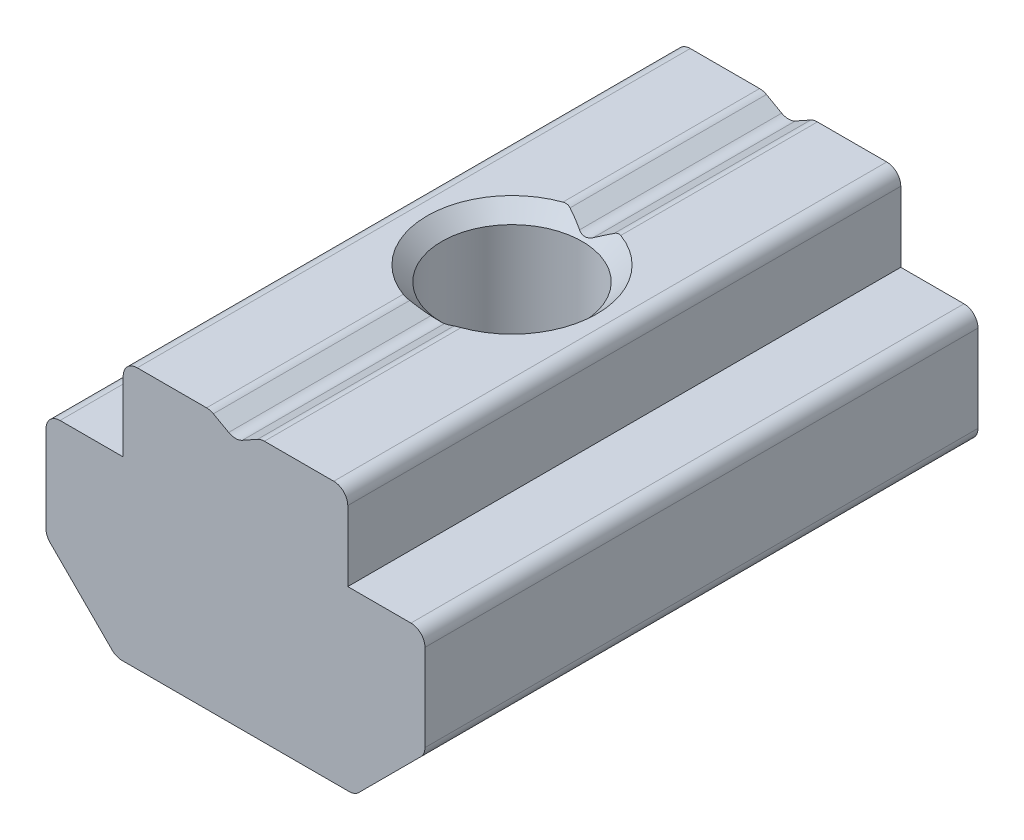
SolidWorks part; units mm, degrees
ref_plane "Front Plane" through (0, 0, 0) normal (0, 0, 1) x (1, 0, 0)
ref_plane "Top Plane" through (0, 0, 0) normal (0, 1, 0) x (1, 0, 0)
ref_plane "Right Plane" through (0, 0, 0) normal (1, 0, 0) x (0, 0, -1)
sketch "Sketch1" plane through (0, 0, 0) normal (0, 1, 0) x (1, 0, 0)
  line L1 (0, 0) -> (13.5, 0)
  line L2 (0, 0) -> (0, 19.7)
  line L3 (0, 19.7) -> (13.5, 19.7)
  line L4 (13.5, 0) -> (13.5, 19.7)
  dimension "D1" = 13.5
  dimension "D2" = 19.7
extrude "Boss-Extrude1" add sketch "Sketch1" along normal blind 9.3
sketch "Sketch2" plane through (0, 9.3, 0) normal (0, 1, 0) x (1, 0, 0)
  line L6 (13.5, 19.7) -> (0, 19.7) construction
  line L7 (2.75, 19.7) -> (10.75, 19.7)
  line L8 (2.75, 19.7) -> (2.75, 0)
  line L9 (2.75, 0) -> (10.75, 0)
  line L10 (10.75, 19.7) -> (10.75, 0)
  line L11 (0, 0) -> (13.5, 0) construction
  line L13 (2.75, 19.7) -> (0, 19.7)
  line L14 (2.75, 19.7) -> (2.75, 0)
  line L15 (2.75, 0) -> (0, 0)
  line L16 (0, 19.7) -> (0, 0)
  line L17 (10.75, 19.7) -> (13.5, 19.7)
  line L18 (10.75, 19.7) -> (10.75, 0)
  line L19 (10.75, 0) -> (13.5, 0)
  line L20 (13.5, 19.7) -> (13.5, 0)
  point P4 (6.75, 19.7)
  point P7 (6.75, 19.7)
  point P8 (6.75, 0)
  point P11 (6.75, 0)
  dimension "D1" = 8
extrude "Cut-Extrude1" cut sketch "Sketch2" against normal blind 3 contours L8 M8 M5 M6 | L10 M8 M6 M7
chamfer "Chamfer1" distance 2.5 angle 45 2 edges at (0, 0, -9.85) (13.5, 0, -9.85)
hole_wizard "M6 Tapped Hole1" positions "Sketch3" profile "Sketch5" tap size "M6" standard "ISO"
sketch "Sketch3" plane through (0, 9.3, 0) normal (0, 1, 0) x (1, 0, 0)
  point P0 (6.75, 9.85)
sketch "Sketch5" plane through (6.75, 9.3, -9.85) normal (1, 0, 0) x (0, 0, 1)
  line L0 (0, 0) -> (0, 9.3)
  line L1 (0, 9.3) -> (3.025, 9.3)
  line L2 (2.5, 8.775) -> (2.5, 0.525)
  line L3 (2.5, 0.525) -> (3.025, 0)
  line L5 (3.025, 0) -> (0, 0)
  line L6 (-2.5, 0.525) -> (-3.025, 0) construction
  line L7 (3.025, 9.3) -> (2.5, 8.775)
  line L8 (-3.025, 9.3) -> (-2.5, 8.775) construction
  line L11 (0, -6.35) -> (0, 107.95) construction
  dimension "Thread Major Dia." = 5
  dimension "Thru Tap Drill Depth" = 9.3
  dimension "Near C'Sink Dia." = 6.05
  dimension "Near C'Sink Angle" = 90
  dimension "Far C'Sink Dia." = 6.05
  dimension "Far C'Sink Angle" = 90
sketch "Sketch6" plane through (0, 0, 0) normal (0, 0, 1) x (1, 0, 0)
  line L0 (6.75, 9.3) -> (6.75, 4.2106) construction
  line L1 (2.75, 9.3) -> (10.75, 9.3) construction
  line L2 (5.85, 9.3) -> (7.65, 9.3)
  line L3 (6.75, 9.3) -> (6.75, 8.8)
  line L4 (5.85, 9.3) -> (6.75, 8.8)
  line L5 (7.65, 9.3) -> (6.75, 8.8)
  point P6 (6.75, 9.3)
  dimension "D1" = 1.8
  dimension "D2" = 0.5
extrude "Cut-Extrude2" cut sketch "Sketch6" against normal up to surface (19.7 mm away) contours L2 L4 L3 | L5 L3 M16
fillet "Fillet1" radius 0.5 14 edges at (0, 2.5, -9.85) (2.5, 0, -9.85) (11, 0, -9.85) (13.5, 2.5, -9.85) (10.75, 9.3, -9.85) (13.5, 6.3, -9.85) (0, 6.3, -9.85) (2.75, 9.3, -9.85) (6.75, 8.8, -16.0375) (6.75, 8.8, -3.6625) (7.65, 9.3, -3.481) (5.85, 9.3, -3.481) (7.65, 9.3, -16.219) (5.85, 9.3, -16.219)
